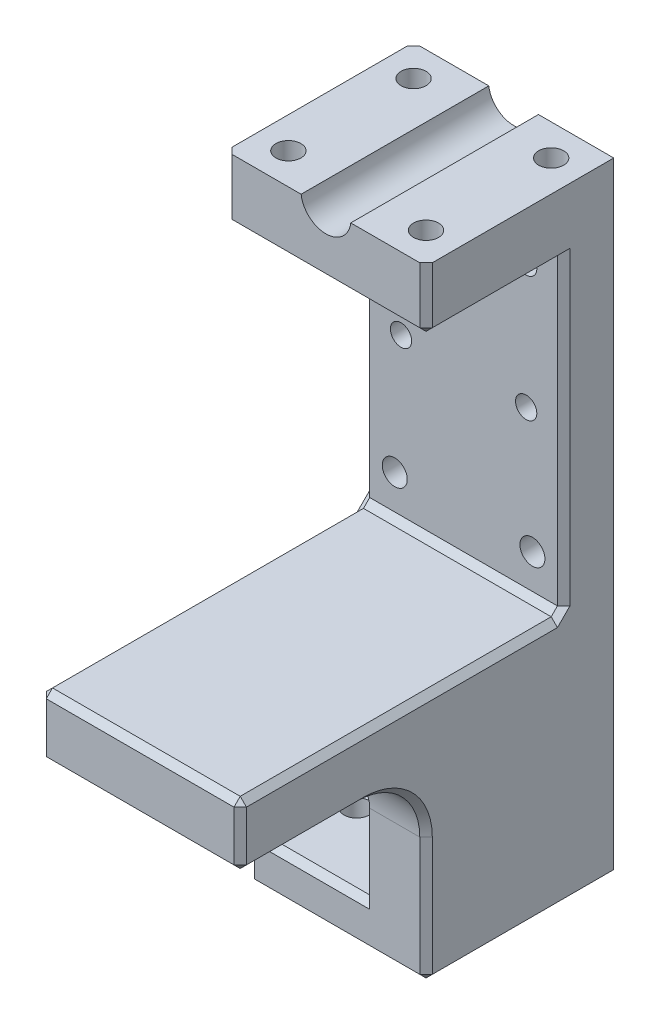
SolidWorks part; units mm, degrees
ref_plane "Aufriss" through (0, 0, 0) normal (0, 0, 1) x (1, 0, 0)
ref_plane "Grundriss" through (0, 0, 0) normal (0, 1, 0) x (1, 0, 0)
ref_plane "Seitenriss" through (0, 0, 0) normal (1, 0, 0) x (0, 0, -1)
sketch "Skizze1" plane through (0, 0, 0) normal (0, 0, 1) x (1, 0, 0)
  line L1 (-16, -29) -> (16, -29)
  line L2 (-16, -29) -> (-16, 29)
  line L3 (-16, 29) -> (16, 29)
  line L4 (16, -29) -> (16, 29)
  line L5 (-16, -29) -> (16, 29) construction
  line L6 (-16, 29) -> (16, -29) construction
  point P0 (0, 0)
  dimension "D1" = 32
  dimension "D2" = 58
extrude "Aufsatz-Linear austragen1" add sketch "Skizze1" against normal blind 30
sketch "Skizze2" plane through (16, 0, 0) normal (1, 0, 0) x (0, 0, -1)
  line L1 (22, -29) -> (0, -29)
  line L2 (22, -29) -> (22, 19)
  line L3 (22, 19) -> (0, 19)
  line L4 (0, -29) -> (0, 19)
  line L5 (30, 29) -> (0, 29) construction
  line L6 (30, -29) -> (30, 29) construction
  dimension "D1" = 10
  dimension "D2" = 8
extrude "Schnitt-Linear austragen1" cut sketch "Skizze2" against normal through all
hole_wizard "Stirnsenkung für M3 Flachkopfschraube mit Schlitz2" positions "Skizze3" profile "Skizze4" counterbore size "M3" standard "DIN"
sketch "Skizze3" plane through (0, 0, -30) normal (0, 0, 1) x (1, 0, 0)
  line L0 (-16, -29) -> (16, -29) construction
  line L1 (16, 29) -> (-16, 29) construction
  point P0 (-10, -4.5)
  point P2 (10, -4.5)
  point P11 (0, -29)
  point P12 (-10, 15.5)
  point P14 (10, 15.5)
  dimension "D1" = 10
  dimension "D2" = 10
  dimension "D3" = 20
  dimension "D4" = 13.5
sketch "Skizze4" plane through (-10, -4.5, -30) normal (1, 0, 0) x (0, 1, 0)
  line L0 (0, 0) -> (0, 30)
  line L1 (0, 30) -> (1.7, 30)
  line L3 (1.7, 30) -> (1.7, 2.4)
  line L4 (1.7, 2.4) -> (3.5, 2.4)
  line L5 (3.5, 2.4) -> (3.5, 0)
  line L7 (3.5, 0) -> (0, 0)
  line L11 (0, -6.35) -> (0, 107.95) construction
  dimension "Bohrerdurchmesser" = 3.4
  dimension "Bohrungstiefe" = 30
  dimension "Senkdurchmesser2" = 7
  dimension "Senktiefe2" = 2.4
hole_wizard "Ø4.0 (4) Durchmesser Bohrung1" positions "Skizze15" profile "Skizze16" hole size "Ø4.0" standard "DIN"
sketch "Skizze15" plane through (0, 0, -30) normal (0, 0, 1) x (1, 0, 0)
  line L3 (-16, -29) -> (-16, 19) construction
  line L4 (-16, -29) -> (16, -29) construction
  line L5 (16, -29) -> (16, 19) construction
  point P0 (-11, -24)
  point P2 (11, -24)
  dimension "D1" = 5
  dimension "D2" = 5
  dimension "D3" = 5
sketch "Skizze16" plane through (-11, -24, -30) normal (1, 0, 0) x (0, 1, 0)
  line L0 (0, 0) -> (0, 30)
  line L1 (0, 30) -> (2, 30)
  line L2 (2, 30) -> (2, 0)
  line L5 (2, 0) -> (0, 0)
  line L11 (0, -6.35) -> (0, 107.95) construction
  dimension "Bohrerdurchmesser" = 4
  dimension "Bohrungstiefe" = 30
sketch "Skizze20" plane through (0, 0, -30) normal (0, 0, -1) x (-1, 0, 0)
  line L0 (-16, 29) -> (16, 29) construction
  circle A0 centre (0, 29.5) radius 4
  dimension "D2" = 8
  dimension "D1" = 0.5
extrude "Schnitt-Linear austragen3" cut sketch "Skizze20" against normal through all
hole_wizard "Ø4.0 (4) Durchmesser Bohrung2" positions "Skizze21" profile "Skizze22" hole size "Ø4.0" standard "DIN"
sketch "Skizze21" plane through (0, 29, 0) normal (0, 1, 0) x (1, 0, 0)
  line L0 (-16, 30) -> (-16, 0) construction
  line L1 (-3.9686, 30) -> (-16, 30) construction
  line L2 (-3.9686, 0) -> (-16, 0) construction
  line L3 (16, 30) -> (16, 0) construction
  point P0 (-11, 25)
  point P2 (11, 25)
  point P4 (11, 5)
  point P6 (-11, 5)
  dimension "D1" = 5
  dimension "D2" = 5
  dimension "D3" = 5
  dimension "D4" = 5
sketch "Skizze22" plane through (-11, 29, -25) normal (1, 0, 0) x (0, 0, 1)
  line L0 (0, 0) -> (0, 7)
  line L1 (0, 7) -> (2, 7)
  line L2 (2, 7) -> (2, 0)
  line L5 (2, 0) -> (0, 0)
  line L10 (0, 7) -> (-2, 7) construction
  line L11 (0, -6.35) -> (0, 107.95) construction
  dimension "Bohrerdurchmesser" = 4
  dimension "Bohrungstiefe" = 7
  dimension "Spitzenwinkel" = 180
sketch "Skizze23" plane through (0, -29, 0) normal (0, -1, 0) x (1, 0, 0)
  line L1 (-16, -22) -> (16, -22)
  line L2 (-16, -22) -> (-16, -30)
  line L3 (-16, -30) -> (16, -30)
  line L4 (16, -22) -> (16, -30)
extrude "Aufsatz-Linear austragen2" add sketch "Skizze23" along normal blind 11.5
sketch "Skizze24" plane through (0, 0, -22) normal (0, 0, 1) x (1, 0, 0)
  line L0 (16, -40.5) -> (16, 19) construction
  line L1 (-16, -40.5) -> (16, -40.5)
  line L2 (-16, -40.5) -> (-16, -30.5)
  line L3 (-16, -30.5) -> (16, -30.5)
  line L4 (16, -40.5) -> (16, -30.5)
  dimension "D1" = 10
extrude "Aufsatz-Linear austragen3" add sketch "Skizze24" along normal blind 51.7
hole_wizard "Ø4.0 (4) Durchmesser Bohrung3" positions "Skizze25" profile "Skizze26" hole size "Ø4.0" standard "DIN"
sketch "Skizze25" plane through (0, -40.5, 0) normal (0, -1, 0) x (-1, 0, 0)
  line L0 (16, -29.7) -> (-16, -29.7) construction
  line L2 (2, -18) -> (2, -24.4) construction
  line L4 (2, -21.2) -> (-5.8, -21.2) construction
  line L6 (-16, 30) -> (-16, -29.7) construction
  point P0 (2, -24.4)
  point P2 (-5.8, -21.2)
  point P9 (2, -18)
  dimension "D1" = 5.3
  dimension "D2" = 7.8
  dimension "D3" = 18
  dimension "D4" = 6.4
sketch "Skizze26" plane through (-2, -40.5, 24.4) normal (1, 0, 0) x (0, 0, -1)
  line L0 (0, 0) -> (0, 7)
  line L1 (0, 7) -> (2, 7)
  line L2 (2, 7) -> (2, 0)
  line L5 (2, 0) -> (0, 0)
  line L10 (0, 7) -> (-2, 7) construction
  line L11 (0, -6.35) -> (0, 107.95) construction
  dimension "Bohrerdurchmesser" = 4
  dimension "Bohrungstiefe" = 7
  dimension "Spitzenwinkel" = 180
sketch "Skizze27" plane through (0, -40.5, 0) normal (0, -1, 0) x (1, 0, 0)
  line L1 (16, -30) -> (6, -30)
  line L2 (16, -30) -> (16, 0)
  line L3 (16, 0) -> (6, 0)
  line L4 (6, -30) -> (6, 0)
  dimension "D1" = 10
  dimension "D2" = 30
extrude "Aufsatz-Linear austragen4" add sketch "Skizze27" along normal blind 30
sketch "Skizze28" plane through (6, 0, 0) normal (-1, 0, 0) x (0, 0, 1)
  line L0 (0, -70.5) -> (0, -40.5) construction
  line L1 (-30, -70.5) -> (0, -70.5)
  line L2 (-30, -70.5) -> (-30, -63.5)
  line L3 (-30, -63.5) -> (0, -63.5)
  line L4 (0, -70.5) -> (0, -63.5)
  dimension "D1" = 7
extrude "Aufsatz-Linear austragen5" add sketch "Skizze28" along normal blind 18.4
hole_wizard "Ø4.0 (4) Durchmesser Bohrung4" positions "Skizze29" profile "Skizze30" hole size "Ø4.0" standard "DIN"
sketch "Skizze29" plane through (0, -70.5, 0) normal (0, -1, 0) x (-1, 0, 0)
  line L0 (12.4, 30) -> (12.4, 0) construction
  line L2 (0.7, 12) -> (7.1, 12) construction
  line L4 (3.9, 19.8) -> (3.9, 12) construction
  line L7 (12.4, 30) -> (-16, 30) construction
  point P0 (7.1, 12)
  point P2 (3.9, 19.8)
  point P12 (0.7, 12)
  dimension "D1" = 5.3
  dimension "D2" = 7.8
  dimension "D3" = 18
  dimension "D4" = 6.4
sketch "Skizze30" plane through (-7.1, -70.5, -12) normal (1, 0, 0) x (0, 0, -1)
  line L0 (0, 0) -> (0, 7)
  line L1 (0, 7) -> (2, 7)
  line L2 (2, 7) -> (2, 0)
  line L5 (2, 0) -> (0, 0)
  line L11 (0, -6.35) -> (0, 107.95) construction
  dimension "Bohrerdurchmesser" = 4
  dimension "Bohrungstiefe" = 7
fillet "Verrundung1" radius 10 2 edges at (6, -40.5, -15) (11, -40.5, 0)
chamfer "Fase2" distance 1 angle 45 27 edges at (-16, 24, 0) (-16, 19, -11) (16, 24, 0) (16, 19, -11) (16, -60.5, 0) (16, -5.75, -22) (-16, -5.75, -22) (16, -43.4289, 2.9289) (-16, -5.75, -30) (-16, -40.5, -0.15) (0, -40.5, 29.7) (16, -40.5, 19.85) (16, -30.5, 3.85) (16, -35.5, 29.7) (0, -30.5, 29.7) (-16, -30.5, 3.85) (-16, -35.5, 29.7) (3.0711, -43.4289, 2.9289) (16, -70.5, -15) (1.8, -70.5, 0) (-12.4, -63.5, -15) (6, -57, 0) (-3.2, -63.5, 0) (-12.4, -67, 0) (-12.4, -70.5, -15) (0, -30.5, -22) (0, 19, 0)
